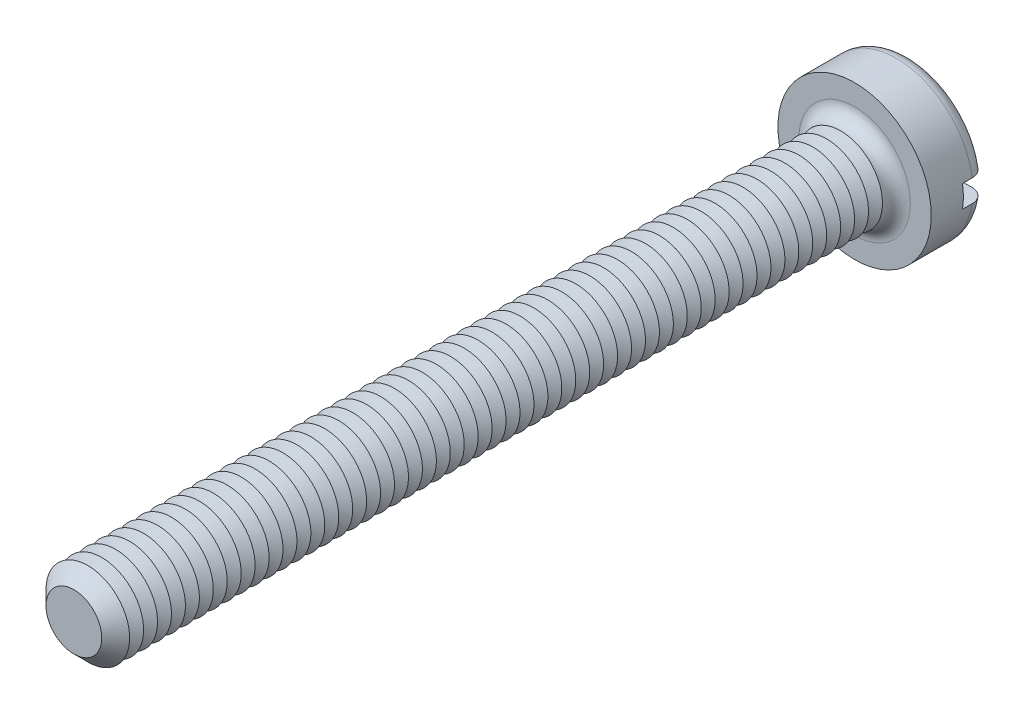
SolidWorks part; units mm, degrees
ref_plane "Front Plane" through (0, 0, 0) normal (0, 0, 1) x (1, 0, 0)
ref_plane "Top Plane" through (0, 0, 0) normal (0, 1, 0) x (1, 0, 0)
ref_plane "Right Plane" through (0, 0, 0) normal (1, 0, 0) x (0, 0, -1)
sketch "Sketch3" plane through (0, 0, 0) normal (0, 0, 1) x (1, 0, 0)
  circle A0 centre (0, 0) radius 2.75
  dimension "D1" = 5.5
extrude "Boss-Extrude2" add sketch "Sketch3" against normal blind 2
sketch "Sketch4" plane through (0, 0, 0) normal (0, 0, 1) x (1, 0, 0)
  circle A0 centre (0, 0) radius 1.5
  dimension "D1" = 3
extrude "Boss-Extrude3" add sketch "Sketch4" along normal blind 28
fillet "Fillet1" radius 0.5 2 edges at (2.75, 0, -2) (1.5, 0, 0)
chamfer "Chamfer1" distance 0.5 angle 45 1 edges at (1.5, 0, 28)
sketch "Sketch5" plane through (0, 0, 0) normal (1, 0, 0) x (0, 0, -1)
  line L0 (1.6944, 0) -> (-7.6738, 0) construction
sketch "Sketch6" plane through (0, 0, 0) normal (1, 0, 0) x (0, 0, -1)
  line L0 (-0.5, 1.5) -> (-0.75, 1.067)
  line L1 (-0.75, 1.067) -> (-1, 1.5)
  line L2 (-0.5, 1.5) -> (-27.5, 1.5) construction
  line L3 (-1, 1.5) -> (-0.5, 1.5)
  dimension "D1" = 0.5
revolve "Cut-Revolve1" cut sketch "Sketch6" angle 360 about L0
pattern_linear "LPattern1" count 54 spacing 0.5 along (0, 0, 1) of "Cut-Revolve1"
sketch "Sketch8" plane through (0, 0, -2) normal (0, 0, -1) x (-1, 0, 0)
  line L1 (2.75, -0.4) -> (-2.75, -0.4)
  line L2 (2.75, -0.4) -> (2.75, 0.4)
  line L3 (2.75, 0.4) -> (-2.75, 0.4)
  line L4 (-2.75, -0.4) -> (-2.75, 0.4)
  line L5 (2.75, -0.4) -> (-2.75, 0.4) construction
  line L6 (2.75, 0.4) -> (-2.75, -0.4) construction
  point P0 (0, 0)
  dimension "D1" = 5.5
  dimension "D2" = 0.8
extrude "Cut-Extrude1" cut sketch "Sketch8" against normal blind 0.85
